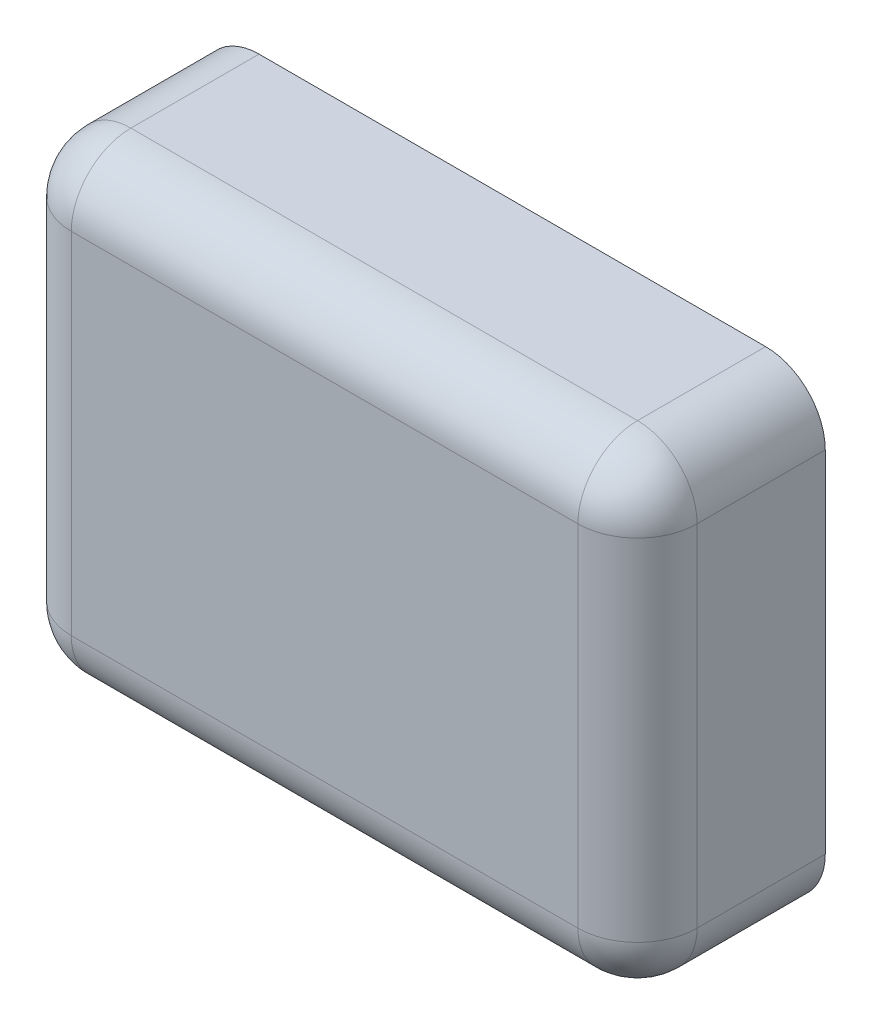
SolidWorks part; units mm, degrees
ref_plane "Front" through (0, 0, 0) normal (0, 0, 1) x (1, 0, 0)
ref_plane "Top" through (0, 0, 0) normal (0, 1, 0) x (1, 0, 0)
ref_plane "Right" through (0, 0, 0) normal (1, 0, 0) x (0, 0, -1)
sketch "Sketch1" plane through (0, 0, 0) normal (0, 0, 1) x (1, 0, 0)
  line L1 (0, 0) -> (200, 0)
  line L2 (0, 0) -> (0, -150)
  line L3 (0, -150) -> (200, -150)
  line L4 (200, 0) -> (200, -150)
  dimension "D1" = 200
  dimension "D2" = 150
extrude "Extrude1" add sketch "Sketch1" along normal blind 60
fillet "Fillet1" radius 19.05
